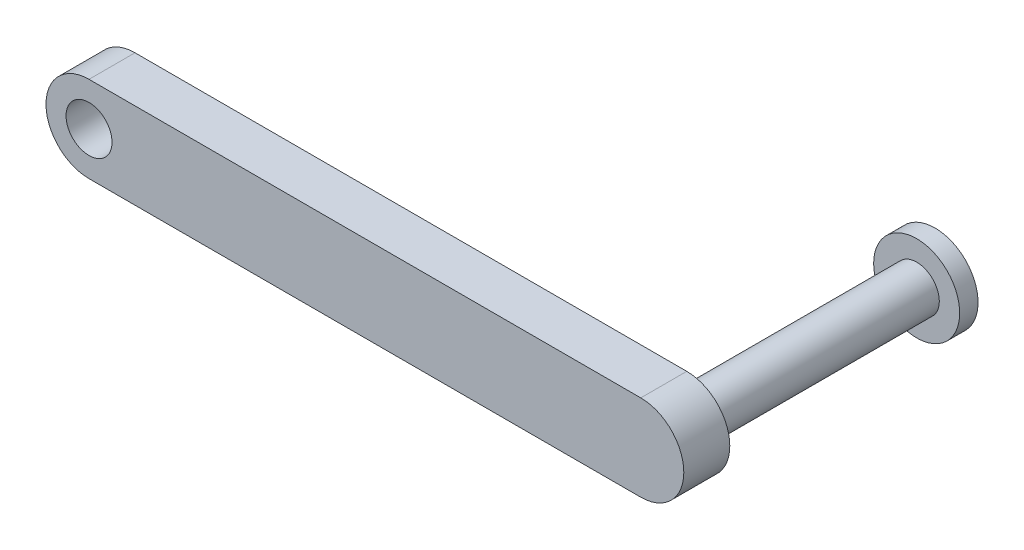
SolidWorks part; units mm, degrees
ref_plane "Front Plane" through (0, 0, 0) normal (0, 0, 1) x (1, 0, 0)
ref_plane "Top Plane" through (0, 0, 0) normal (0, 1, 0) x (1, 0, 0)
ref_plane "Right Plane" through (0, 0, 0) normal (1, 0, 0) x (0, 0, -1)
sketch "Sketch1" plane through (0, 0, 0) normal (0, 0, 1) x (1, 0, 0)
  line L0 (-23.9285, 0) -> (52.2715, 0) construction
  line L1 (-23.9285, 5.9413) -> (52.2715, 5.9413)
  line L2 (-23.9285, -5.9413) -> (52.2715, -5.9413)
  arc A0 (-23.9285, 5.9413) -> (-23.9285, -5.9413) centre (-23.9285, 0) ccw
  arc A1 (52.2715, -5.9413) -> (52.2715, 5.9413) centre (52.2715, 0) ccw
  circle A2 centre (-23.9285, 0) radius 3.175
  circle A3 centre (52.2715, 0) radius 3.1279
  point P3 (14.1715, 0)
  dimension "D1" = 76.2
  dimension ".25" = 6.35
extrude "Boss-Extrude1" add sketch "Sketch1" along normal blind 6.35
sketch "Sketch2" plane through (0, 0, 6.35) normal (0, 0, 1) x (1, 0, 0)
  circle A0 centre (52.2715, 0) radius 3.1279
extrude "Boss-Extrude2" add sketch "Sketch2" against normal blind 38.1
sketch "Sketch3" plane through (0, 0, -31.75) normal (0, 0, -1) x (-1, 0, 0)
  circle A0 centre (-52.2715, 0) radius 5.9413
extrude "Boss-Extrude3" add sketch "Sketch3" along normal blind 2.54
